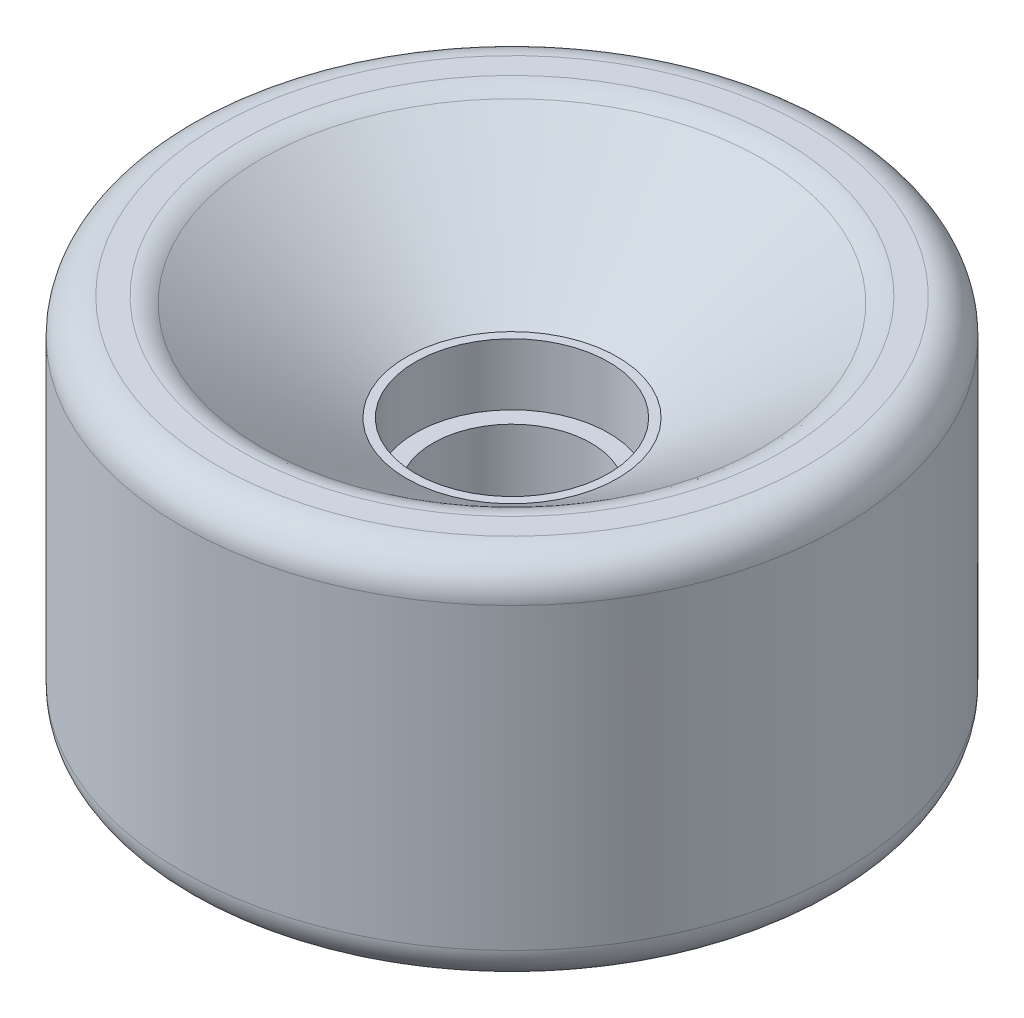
SolidWorks part; units mm, degrees
ref_plane "Front Plane" through (0, 0, 0) normal (0, 0, 1) x (1, 0, 0)
ref_plane "Top Plane" through (0, 0, 0) normal (0, 1, 0) x (1, 0, 0)
ref_plane "Right Plane" through (0, 0, 0) normal (1, 0, 0) x (0, 0, -1)
sketch "Sketch1" plane through (0, 0, 0) normal (0, 0, 1) x (1, 0, 0)
  line L0 (0, 21) -> (0, -21) construction
  line L1 (9, 2) -> (9, -8)
  line L2 (9, -8) -> (11, -8)
  line L3 (11, -8) -> (11, -15)
  line L4 (11, -15) -> (12, -15)
  line L5 (29.5, -21) -> (37.5, -21)
  line L6 (37.5, -21) -> (37.5, 21)
  line L7 (37.5, 21) -> (29.5, 21)
  line L8 (12, -15) -> (29.5, -21)
  line L9 (9, 2) -> (11, 2)
  line L10 (11, 2) -> (11, 9)
  line L11 (11, 9) -> (12, 9)
  line L12 (12, 9) -> (29.5, 21)
  point P5 (9, -3)
  dimension "D1" = 42
  dimension "D2" = 7
  dimension "D3" = 10
  dimension "D4" = 11
  dimension "D5" = 1
  dimension "D6" = 2
  dimension "RADIUS" = 37.5
  dimension "D7" = 8
  dimension "D8" = 3
revolve "Revolve1" add sketch "Sketch1" angle 360 about L0
fillet "Fillet1" radius 4 4 edges at (0, -21, 29.5) (0, 21, 29.5) (0, -21, 37.5) (0, 21, 37.5)
